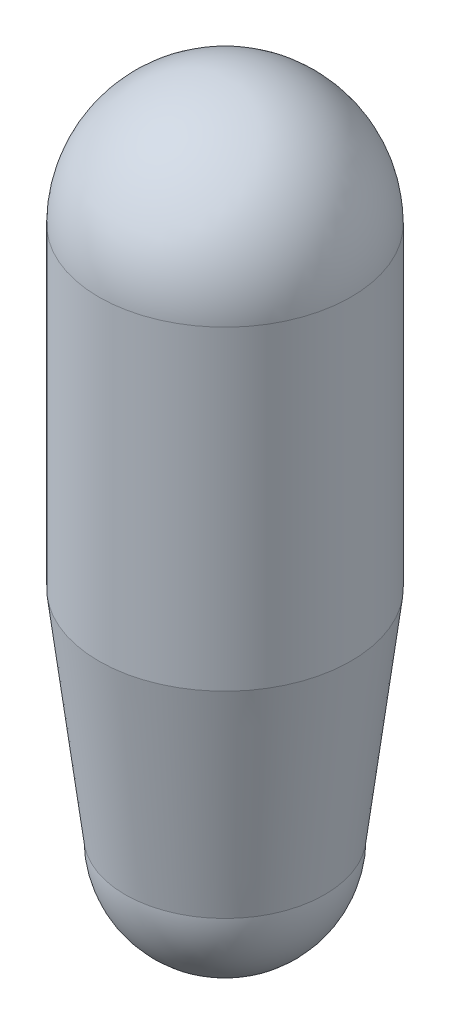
SolidWorks part; units mm, degrees
ref_plane "Front Plane" through (0, 0, 0) normal (0, 0, 1) x (1, 0, 0)
ref_plane "Top Plane" through (0, 0, 0) normal (0, 1, 0) x (1, 0, 0)
ref_plane "Right Plane" through (0, 0, 0) normal (1, 0, 0) x (0, 0, -1)
sketch "Sketch1" plane through (0, 0, 0) normal (0, 0, 1) x (1, 0, 0)
  line L0 (-60.96, 0) -> (60.96, 0)
  arc A0 (60.96, 0) -> (-60.96, 0) centre (0, 0) ccw
  dimension "D1" = 121.92
revolve "Revolve1" add sketch "Sketch1" angle 360 about L0
sketch "Sketch2" plane through (0, 0, 0) normal (0, 0, 1) x (1, 0, 0)
  line L0 (-48.26, -256.54) -> (48.26, -256.54)
  arc A0 (-48.26, -256.54) -> (48.26, -256.54) centre (0, -256.54) ccw
  arc A1 (60.96, 0) -> (-60.96, 0) centre (0, 0) ccw construction
  dimension "D1" = 96.52
  dimension "D2" = 365.76
revolve "Revolve2" add sketch "Sketch2" angle 360 about L0
sketch "Sketch3" plane through (0, 0, 0) normal (1, 0, 0) x (0, 0, -1)
  line L0 (0, 0) -> (0, -256.54)
  line L1 (0, -256.54) -> (48.26, -256.54)
  line L2 (48.26, -256.54) -> (60.96, 0) construction
  line L3 (60.96, 0) -> (0, 0)
  line L4 (60.96, 0) -> (60.96, -152.4)
  line L5 (60.96, -152.4) -> (48.26, -256.54)
  circle A0 centre (0, 0) radius 60.96 construction
  circle A1 centre (0, -256.54) radius 48.26 construction
  dimension "D2" = 152.4
revolve "Revolve3" add sketch "Sketch3" angle 360 about L0
